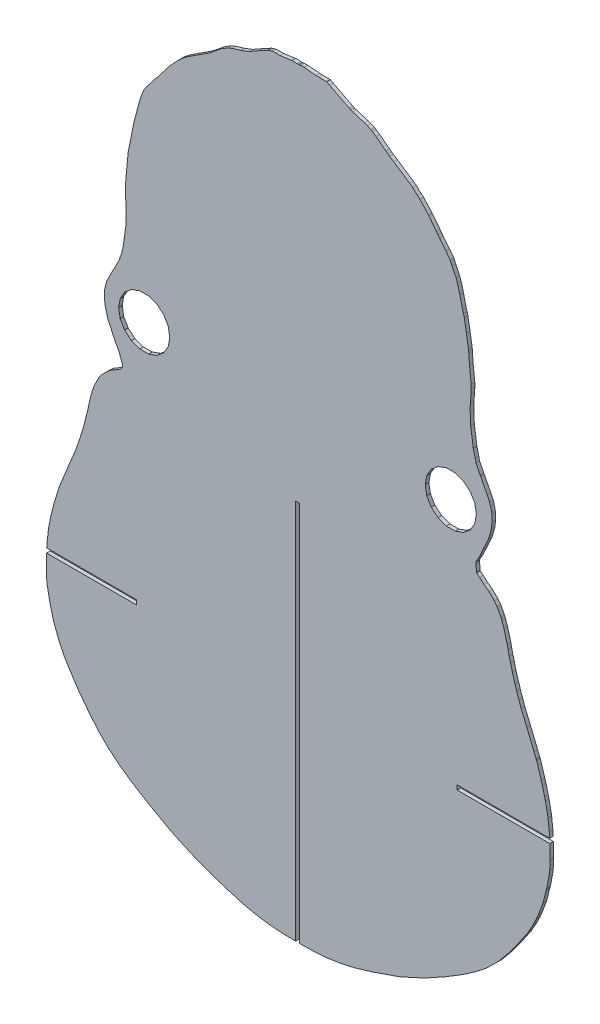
SolidWorks part; units mm, degrees
ref_plane "Спереди" through (0, 0, 0) normal (0, 0, 1) x (1, 0, 0)
ref_plane "Сверху" through (0, 0, 0) normal (0, 1, 0) x (1, 0, 0)
ref_plane "Справа" through (0, 0, 0) normal (1, 0, 0) x (0, 0, -1)
sketch "Model" plane through (0, 0, 0) normal (0, 0, 1) x (1, 0, 0)
  line L0 (-4974.158, -929.7955) -> (-4968.6351, -930.2084)
  line L1 (-4968.6351, -930.2084) -> (-4965.1293, -930.3378)
  line L2 (-4965.1293, -930.3378) -> (-4959.8611, -930.4225)
  line L3 (-4959.8611, -930.4225) -> (-4959.8611, -719.0788)
  line L4 (-4959.8611, -719.0788) -> (-4957.8611, -719.0788)
  line L5 (-4957.8611, -719.0788) -> (-4957.8611, -930.4371)
  line L6 (-4957.8611, -930.4371) -> (-4951.7398, -930.3629)
  line L7 (-4951.7398, -930.3629) -> (-4949.5986, -930.2921)
  line L8 (-4949.5986, -930.2921) -> (-4947.9002, -930.1979)
  line L9 (-4947.9002, -930.1979) -> (-4942.8325, -929.8058)
  line L10 (-4942.8325, -929.8058) -> (-4942.4503, -929.756)
  line L11 (-4942.4503, -929.756) -> (-4935.1129, -928.6329)
  line L12 (-4935.1129, -928.6329) -> (-4934.8096, -928.5712)
  line L13 (-4934.8096, -928.5712) -> (-4934.5061, -928.5092)
  line L14 (-4934.5061, -928.5092) -> (-4927.6871, -926.9908)
  line L15 (-4927.6871, -926.9908) -> (-4926.8901, -926.7667)
  line L16 (-4926.8901, -926.7667) -> (-4921.6101, -925.1852)
  line L17 (-4921.6101, -925.1852) -> (-4919.9321, -924.703)
  line L18 (-4919.9321, -924.703) -> (-4918.2541, -924.2206)
  line L19 (-4918.2541, -924.2206) -> (-4908.5771, -920.9071)
  line L20 (-4908.5771, -920.9071) -> (-4902.6554, -918.8368)
  line L21 (-4902.6554, -918.8368) -> (-4896.7513, -916.2242)
  line L22 (-4896.7513, -916.2242) -> (-4888.4404, -912.3805)
  line L23 (-4888.4404, -912.3805) -> (-4887.0179, -911.6324)
  line L24 (-4887.0179, -911.6324) -> (-4883.3795, -909.6022)
  line L25 (-4883.3795, -909.6022) -> (-4877.945, -906.5407)
  line L26 (-4877.945, -906.5407) -> (-4877.4139, -906.285)
  line L27 (-4877.4139, -906.285) -> (-4876.8827, -906.0292)
  line L28 (-4876.8827, -906.0292) -> (-4870.752, -902.2738)
  line L29 (-4870.752, -902.2738) -> (-4865.5499, -899.0272)
  line L30 (-4865.5499, -899.0272) -> (-4864.6683, -898.4178)
  line L31 (-4864.6683, -898.4178) -> (-4863.5197, -897.5741)
  line L32 (-4863.5197, -897.5741) -> (-4862.3711, -896.7306)
  line L33 (-4862.3711, -896.7306) -> (-4859.876, -895.0631)
  line L34 (-4859.876, -895.0631) -> (-4856.9983, -892.7367)
  line L35 (-4856.9983, -892.7367) -> (-4854.0229, -890.3763)
  line L36 (-4854.0229, -890.3763) -> (-4848.1192, -884.5961)
  line L37 (-4848.1192, -884.5961) -> (-4846.7538, -883.0995)
  line L38 (-4846.7538, -883.0995) -> (-4842.3308, -877.7321)
  line L39 (-4842.3308, -877.7321) -> (-4836.8335, -870.3651)
  line L40 (-4836.8335, -870.3651) -> (-4832.9334, -864.5707)
  line L41 (-4832.9334, -864.5707) -> (-4831.4924, -862.5199)
  line L42 (-4831.4924, -862.5199) -> (-4830.8341, -861.4086)
  line L43 (-4830.8341, -861.4086) -> (-4830.6526, -861.0438)
  line L44 (-4830.6526, -861.0438) -> (-4830.4712, -860.6793)
  line L45 (-4830.4712, -860.6793) -> (-4828.6733, -857.6239)
  line L46 (-4828.6733, -857.6239) -> (-4828.1669, -856.5897)
  line L47 (-4828.1669, -856.5897) -> (-4826.4759, -853.1464)
  line L48 (-4826.4759, -853.1464) -> (-4825.3825, -850.5316)
  line L49 (-4825.3825, -850.5316) -> (-4822.6957, -843.3907)
  line L50 (-4822.6957, -843.3907) -> (-4822.6899, -843.3458)
  line L51 (-4822.6899, -843.3458) -> (-4822.6841, -843.3009)
  line L52 (-4822.6841, -843.3009) -> (-4821.1044, -836.9054)
  line L53 (-4821.1044, -836.9054) -> (-4820.9418, -836.3578)
  line L54 (-4820.9418, -836.3578) -> (-4820.7793, -835.8099)
  line L55 (-4820.7793, -835.8099) -> (-4820.6542, -835.2631)
  line L56 (-4820.6542, -835.2631) -> (-4819.4245, -829.0065)
  line L57 (-4819.4245, -829.0065) -> (-4819.0711, -826.1041)
  line L58 (-4819.0711, -826.1041) -> (-4818.8331, -823.6173)
  line L59 (-4818.8331, -823.6173) -> (-4818.8422, -821.382)
  line L60 (-4818.8422, -821.382) -> (-4818.8378, -821.0985)
  line L61 (-4818.8378, -821.0985) -> (-4818.8757, -820.3788)
  line L62 (-4818.8757, -820.3788) -> (-4818.9844, -813.0892)
  line L63 (-4818.9844, -813.0892) -> (-4870.3844, -813.0892)
  line L64 (-4870.3844, -813.0892) -> (-4870.3844, -812.8392)
  line L65 (-4870.3844, -812.8392) -> (-4870.3844, -810.8392)
  line L66 (-4870.3844, -810.8392) -> (-4870.3844, -810.5892)
  line L67 (-4870.3844, -810.5892) -> (-4819.0458, -810.5892)
  line L68 (-4819.0458, -810.5892) -> (-4819.2605, -807.7255)
  line L69 (-4819.2605, -807.7255) -> (-4819.9747, -801.4142)
  line L70 (-4819.9747, -801.4142) -> (-4820.2251, -799.7928)
  line L71 (-4820.2251, -799.7928) -> (-4821.3856, -793.9696)
  line L72 (-4821.3856, -793.9696) -> (-4821.8597, -792.1036)
  line L73 (-4821.8597, -792.1036) -> (-4823.0798, -787.2887)
  line L74 (-4823.0798, -787.2887) -> (-4823.752, -784.9999)
  line L75 (-4823.752, -784.9999) -> (-4825.7052, -778.6901)
  line L76 (-4825.7052, -778.6901) -> (-4826.2635, -777.0309)
  line L77 (-4826.2635, -777.0309) -> (-4826.3465, -776.7943)
  line L78 (-4826.3465, -776.7943) -> (-4826.4295, -776.558)
  line L79 (-4826.4295, -776.558) -> (-4826.5423, -776.2694)
  line L80 (-4826.5423, -776.2694) -> (-4826.6551, -775.9811)
  line L81 (-4826.6551, -775.9811) -> (-4827.7262, -773.4261)
  line L82 (-4827.7262, -773.4261) -> (-4831.693, -763.6888)
  line L83 (-4831.693, -763.6888) -> (-4834.8637, -756.1723)
  line L84 (-4834.8637, -756.1723) -> (-4836.147, -752.5556)
  line L85 (-4836.147, -752.5556) -> (-4837.3583, -749.0107)
  line L86 (-4837.3583, -749.0107) -> (-4838.2948, -746.0696)
  line L87 (-4838.2948, -746.0696) -> (-4839.7543, -741.1841)
  line L88 (-4839.7543, -741.1841) -> (-4840.73, -737.2285)
  line L89 (-4840.73, -737.2285) -> (-4841.5153, -734.2759)
  line L90 (-4841.5153, -734.2759) -> (-4842.1721, -731.301)
  line L91 (-4842.1721, -731.301) -> (-4842.5612, -729.4475)
  line L92 (-4842.5612, -729.4475) -> (-4844.4167, -722.4553)
  line L93 (-4844.4167, -722.4553) -> (-4845.615, -719.1135)
  line L94 (-4845.615, -719.1135) -> (-4846.1162, -717.8667)
  line L95 (-4846.1162, -717.8667) -> (-4848.1593, -714.0344)
  line L96 (-4848.1593, -714.0344) -> (-4849.7675, -711.9243)
  line L97 (-4849.7675, -711.9243) -> (-4852.7505, -708.843)
  line L98 (-4852.7505, -708.843) -> (-4855.4501, -706.9629)
  line L99 (-4855.4501, -706.9629) -> (-4857.8761, -704.7331)
  line L100 (-4857.8761, -704.7331) -> (-4859.5853, -703.469)
  line L101 (-4859.5853, -703.469) -> (-4859.6002, -703.4375)
  line L102 (-4859.6002, -703.4375) -> (-4859.6152, -703.406)
  line L103 (-4859.6152, -703.406) -> (-4859.6202, -703.1538)
  line L104 (-4859.6202, -703.1538) -> (-4859.9137, -699.2248)
  line L105 (-4859.9137, -699.2248) -> (-4859.8963, -698.3071)
  line L106 (-4859.8963, -698.3071) -> (-4859.1325, -696.74)
  line L107 (-4859.1325, -696.74) -> (-4857.966, -694.8115)
  line L108 (-4857.966, -694.8115) -> (-4856.0334, -690.5195)
  line L109 (-4856.0334, -690.5195) -> (-4856.0332, -690.5188)
  line L110 (-4856.0332, -690.5188) -> (-4856.0329, -690.5183)
  line L111 (-4856.0329, -690.5183) -> (-4856.0325, -690.5173)
  line L112 (-4856.0325, -690.5173) -> (-4856.0322, -690.5163)
  line L113 (-4856.0322, -690.5163) -> (-4852.987, -683.9487)
  line L114 (-4852.987, -683.9487) -> (-4852.4202, -682.0217)
  line L115 (-4852.4202, -682.0217) -> (-4851.3934, -678.1655)
  line L116 (-4851.3934, -678.1655) -> (-4851.0131, -674.6946)
  line L117 (-4851.0131, -674.6946) -> (-4851.1242, -670.8762)
  line L118 (-4851.1242, -670.8762) -> (-4851.28, -669.9158)
  line L119 (-4851.28, -669.9158) -> (-4851.8411, -667.6953)
  line L120 (-4851.8411, -667.6953) -> (-4852.3329, -665.9238)
  line L121 (-4852.3329, -665.9238) -> (-4853.6626, -662.9949)
  line L122 (-4853.6626, -662.9949) -> (-4857.2618, -656.0876)
  line L123 (-4857.2618, -656.0876) -> (-4857.4419, -655.7597)
  line L124 (-4857.4419, -655.7597) -> (-4857.6221, -655.4321)
  line L125 (-4857.6221, -655.4321) -> (-4857.6708, -655.3193)
  line L126 (-4857.6708, -655.3193) -> (-4859.894, -650.8657)
  line L127 (-4859.894, -650.8657) -> (-4860.3363, -648.8789)
  line L128 (-4860.3363, -648.8789) -> (-4861.37, -644.7202)
  line L129 (-4861.37, -644.7202) -> (-4861.4316, -644.3179)
  line L130 (-4861.4316, -644.3179) -> (-4862.8359, -634.3913)
  line L131 (-4862.8359, -634.3913) -> (-4862.841, -634.3581)
  line L132 (-4862.841, -634.3581) -> (-4862.8462, -634.3249)
  line L133 (-4862.8462, -634.3249) -> (-4862.8466, -634.3218)
  line L134 (-4862.8466, -634.3218) -> (-4862.847, -634.3186)
  line L135 (-4862.847, -634.3186) -> (-4863.1181, -627.4463)
  line L136 (-4863.1181, -627.4463) -> (-4863.0723, -623.7153)
  line L137 (-4863.0723, -623.7153) -> (-4862.6688, -619.4426)
  line L138 (-4862.6688, -619.4426) -> (-4862.5345, -616.4482)
  line L139 (-4862.5345, -616.4482) -> (-4862.5747, -614.5293)
  line L140 (-4862.5747, -614.5293) -> (-4863.5302, -605.414)
  line L141 (-4863.5302, -605.414) -> (-4863.9102, -600.1826)
  line L142 (-4863.9102, -600.1826) -> (-4863.9584, -598.9465)
  line L143 (-4863.9584, -598.9465) -> (-4864.0995, -597.9158)
  line L144 (-4864.0995, -597.9158) -> (-4865.1712, -591.3637)
  line L145 (-4865.1712, -591.3637) -> (-4866.3972, -584.3789)
  line L146 (-4866.3972, -584.3789) -> (-4866.7994, -582.813)
  line L147 (-4866.7994, -582.813) -> (-4867.3376, -580.9602)
  line L148 (-4867.3376, -580.9602) -> (-4868.8091, -574.6103)
  line L149 (-4868.8091, -574.6103) -> (-4870.1731, -569.5923)
  line L150 (-4870.1731, -569.5923) -> (-4871.0017, -567.237)
  line L151 (-4871.0017, -567.237) -> (-4873.1798, -562.8191)
  line L152 (-4873.1798, -562.8191) -> (-4874.2875, -560.3891)
  line L153 (-4874.2875, -560.3891) -> (-4876.5796, -557.3596)
  line L154 (-4876.5796, -557.3596) -> (-4880.1191, -553.0461)
  line L155 (-4880.1191, -553.0461) -> (-4881.0413, -551.7251)
  line L156 (-4881.0413, -551.7251) -> (-4881.8473, -550.5952)
  line L157 (-4881.8473, -550.5952) -> (-4886.07, -545.1618)
  line L158 (-4886.07, -545.1618) -> (-4886.1833, -545.021)
  line L159 (-4886.1833, -545.021) -> (-4886.2966, -544.8804)
  line L160 (-4886.2966, -544.8804) -> (-4891.0608, -539.6433)
  line L161 (-4891.0608, -539.6433) -> (-4892.4383, -538.5622)
  line L162 (-4892.4383, -538.5622) -> (-4895.2125, -535.8989)
  line L163 (-4895.2125, -535.8989) -> (-4896.6491, -534.8926)
  line L164 (-4896.6491, -534.8926) -> (-4905.5206, -528.9497)
  line L165 (-4905.5206, -528.9497) -> (-4907.8607, -527.4783)
  line L166 (-4907.8607, -527.4783) -> (-4908.7246, -526.8691)
  line L167 (-4908.7246, -526.8691) -> (-4909.7869, -526.008)
  line L168 (-4909.7869, -526.008) -> (-4915.2931, -521.7969)
  line L169 (-4915.2931, -521.7969) -> (-4917.3051, -520.4197)
  line L170 (-4917.3051, -520.4197) -> (-4917.7934, -520.1213)
  line L171 (-4917.7934, -520.1213) -> (-4918.2818, -519.823)
  line L172 (-4918.2818, -519.823) -> (-4920.2479, -518.9287)
  line L173 (-4920.2479, -518.9287) -> (-4921.712, -518.3862)
  line L174 (-4921.712, -518.3862) -> (-4928.1213, -516.4355)
  line L175 (-4928.1213, -516.4355) -> (-4928.5135, -516.3276)
  line L176 (-4928.5135, -516.3276) -> (-4928.9057, -516.2197)
  line L177 (-4928.9057, -516.2197) -> (-4929.3313, -516.0168)
  line L178 (-4929.3313, -516.0168) -> (-4929.8046, -515.7688)
  line L179 (-4929.8046, -515.7688) -> (-4930.2778, -515.5207)
  line L180 (-4930.2778, -515.5207) -> (-4941.071, -510.0259)
  line L181 (-4941.071, -510.0259) -> (-4942.542, -509.2473)
  line L182 (-4942.542, -509.2473) -> (-4942.7693, -509.1418)
  line L183 (-4942.7693, -509.1418) -> (-4947.0627, -509.094)
  line L184 (-4947.0627, -509.094) -> (-4948.4269, -509.0908)
  line L185 (-4948.4269, -509.0908) -> (-4948.4885, -509.094)
  line L186 (-4948.4885, -509.094) -> (-4948.55, -509.0974)
  line L187 (-4948.55, -509.0974) -> (-4954.9997, -508.4509)
  line L188 (-4954.9997, -508.4509) -> (-4955.3121, -508.4067)
  line L189 (-4955.3121, -508.4067) -> (-4956.9597, -508.5312)
  line L190 (-4956.9597, -508.5312) -> (-4957.3478, -508.5642)
  line L191 (-4957.3478, -508.5642) -> (-4957.7359, -508.5971)
  line L192 (-4957.7359, -508.5971) -> (-4957.8421, -508.6238)
  line L193 (-4957.8421, -508.6238) -> (-4957.9483, -508.6504)
  line L194 (-4957.9483, -508.6504) -> (-4958.0066, -508.6513)
  line L195 (-4958.0066, -508.6513) -> (-4958.4723, -508.6294)
  line L196 (-4958.4723, -508.6294) -> (-4958.9379, -508.6076)
  line L197 (-4958.9379, -508.6076) -> (-4961.6012, -508.5432)
  line L198 (-4961.6012, -508.5432) -> (-4962.0373, -508.5957)
  line L199 (-4962.0373, -508.5957) -> (-4962.2339, -508.6333)
  line L200 (-4962.2339, -508.6333) -> (-4962.4303, -508.6709)
  line L201 (-4962.4303, -508.6709) -> (-4968.7091, -509.5178)
  line L202 (-4968.7091, -509.5178) -> (-4969.7684, -509.4753)
  line L203 (-4969.7684, -509.4753) -> (-4970.8276, -509.4328)
  line L204 (-4970.8276, -509.4328) -> (-4972.7218, -509.5388)
  line L205 (-4972.7218, -509.5388) -> (-4973.7364, -509.8718)
  line L206 (-4973.7364, -509.8718) -> (-4974.7509, -510.2051)
  line L207 (-4974.7509, -510.2051) -> (-4975.3609, -510.344)
  line L208 (-4975.3609, -510.344) -> (-4977.9656, -511.8984)
  line L209 (-4977.9656, -511.8984) -> (-4979.7461, -512.7612)
  line L210 (-4979.7461, -512.7612) -> (-4985.8459, -516.2109)
  line L211 (-4985.8459, -516.2109) -> (-4990.3016, -517.8916)
  line L212 (-4990.3016, -517.8916) -> (-4990.573, -517.968)
  line L213 (-4990.573, -517.968) -> (-4994.9819, -519.2717)
  line L214 (-4994.9819, -519.2717) -> (-4997.1963, -520.2471)
  line L215 (-4997.1963, -520.2471) -> (-5000.6361, -522.1443)
  line L216 (-5000.6361, -522.1443) -> (-5000.9295, -522.3701)
  line L217 (-5000.9295, -522.3701) -> (-5001.2229, -522.5959)
  line L218 (-5001.2229, -522.5959) -> (-5007.8338, -527.9165)
  line L219 (-5007.8338, -527.9165) -> (-5013.9421, -531.8899)
  line L220 (-5013.9421, -531.8899) -> (-5019.9042, -535.7637)
  line L221 (-5019.9042, -535.7637) -> (-5023.0545, -538.1955)
  line L222 (-5023.0545, -538.1955) -> (-5025.4924, -540.4707)
  line L223 (-5025.4924, -540.4707) -> (-5029.9923, -545.3574)
  line L224 (-5029.9923, -545.3574) -> (-5030.0162, -545.3869)
  line L225 (-5030.0162, -545.3869) -> (-5030.04, -545.4165)
  line L226 (-5030.04, -545.4165) -> (-5030.2854, -545.7341)
  line L227 (-5030.2854, -545.7341) -> (-5036.7858, -554.2068)
  line L228 (-5036.7858, -554.2068) -> (-5037.5456, -555.0381)
  line L229 (-5037.5456, -555.0381) -> (-5038.4139, -556.0493)
  line L230 (-5038.4139, -556.0493) -> (-5040.6311, -559.0368)
  line L231 (-5040.6311, -559.0368) -> (-5042.7709, -561.7732)
  line L232 (-5042.7709, -561.7732) -> (-5044.0081, -563.6841)
  line L233 (-5044.0081, -563.6841) -> (-5045.2438, -566.5271)
  line L234 (-5045.2438, -566.5271) -> (-5046.164, -569.4292)
  line L235 (-5046.164, -569.4292) -> (-5046.6401, -570.9145)
  line L236 (-5046.6401, -570.9145) -> (-5049.4321, -581.6291)
  line L237 (-5049.4321, -581.6291) -> (-5049.4399, -581.6565)
  line L238 (-5049.4399, -581.6565) -> (-5049.4477, -581.6838)
  line L239 (-5049.4477, -581.6838) -> (-5049.4604, -581.7261)
  line L240 (-5049.4604, -581.7261) -> (-5049.4732, -581.7683)
  line L241 (-5049.4732, -581.7683) -> (-5050.3082, -585.8926)
  line L242 (-5050.3082, -585.8926) -> (-5052.7453, -597.9602)
  line L243 (-5052.7453, -597.9602) -> (-5053.0653, -601.185)
  line L244 (-5053.0653, -601.185) -> (-5054.2401, -614.0129)
  line L245 (-5054.2401, -614.0129) -> (-5054.3111, -616.4817)
  line L246 (-5054.3111, -616.4817) -> (-5054.1294, -620.865)
  line L247 (-5054.1294, -620.865) -> (-5053.8653, -624.2263)
  line L248 (-5053.8653, -624.2263) -> (-5053.8126, -627.0261)
  line L249 (-5053.8126, -627.0261) -> (-5054.0817, -634.468)
  line L250 (-5054.0817, -634.468) -> (-5054.0818, -634.4709)
  line L251 (-5054.0818, -634.4709) -> (-5054.0818, -634.4741)
  line L252 (-5054.0818, -634.4741) -> (-5054.0818, -634.4753)
  line L253 (-5054.0818, -634.4753) -> (-5054.082, -634.478)
  line L254 (-5054.082, -634.478) -> (-5055.513, -644.4607)
  line L255 (-5055.513, -644.4607) -> (-5055.6158, -645.0737)
  line L256 (-5055.6158, -645.0737) -> (-5056.5313, -649.0344)
  line L257 (-5056.5313, -649.0344) -> (-5057.1505, -650.3149)
  line L258 (-5057.1505, -650.3149) -> (-5057.5707, -652.0019)
  line L259 (-5057.5707, -652.0019) -> (-5059.2935, -655.3701)
  line L260 (-5059.2935, -655.3701) -> (-5059.3111, -655.4184)
  line L261 (-5059.3111, -655.4184) -> (-5059.3287, -655.467)
  line L262 (-5059.3287, -655.467) -> (-5059.3846, -655.5666)
  line L263 (-5059.3846, -655.5666) -> (-5059.4406, -655.6665)
  line L264 (-5059.4406, -655.6665) -> (-5063.3718, -663.1562)
  line L265 (-5063.3718, -663.1562) -> (-5064.6885, -666.0378)
  line L266 (-5064.6885, -666.0378) -> (-5065.1107, -667.7178)
  line L267 (-5065.1107, -667.7178) -> (-5065.6793, -669.821)
  line L268 (-5065.6793, -669.821) -> (-5065.8625, -670.8962)
  line L269 (-5065.8625, -670.8962) -> (-5065.9435, -674.4319)
  line L270 (-5065.9435, -674.4319) -> (-5065.525, -677.9663)
  line L271 (-5065.525, -677.9663) -> (-5064.442, -682.1885)
  line L272 (-5064.442, -682.1885) -> (-5063.8631, -684.1135)
  line L273 (-5063.8631, -684.1135) -> (-5062.1041, -687.7156)
  line L274 (-5062.1041, -687.7156) -> (-5061.7643, -688.6572)
  line L275 (-5061.7643, -688.6572) -> (-5061.323, -689.675)
  line L276 (-5061.323, -689.675) -> (-5058.7935, -694.5998)
  line L277 (-5058.7935, -694.5998) -> (-5057.3415, -697.331)
  line L278 (-5057.3415, -697.331) -> (-5057.1786, -698.1245)
  line L279 (-5057.1786, -698.1245) -> (-5055.9685, -701.3669)
  line L280 (-5055.9685, -701.3669) -> (-5055.9156, -702.7766)
  line L281 (-5055.9156, -702.7766) -> (-5057.136, -704.5237)
  line L282 (-5057.136, -704.5237) -> (-5061.8888, -707.1865)
  line L283 (-5061.8888, -707.1865) -> (-5063.264, -708.1726)
  line L284 (-5063.264, -708.1726) -> (-5063.5638, -708.4267)
  line L285 (-5063.5638, -708.4267) -> (-5063.8636, -708.6809)
  line L286 (-5063.8636, -708.6809) -> (-5067.2123, -711.9514)
  line L287 (-5067.2123, -711.9514) -> (-5067.8894, -712.8371)
  line L288 (-5067.8894, -712.8371) -> (-5068.7171, -713.8647)
  line L289 (-5068.7171, -713.8647) -> (-5069.3651, -715.1662)
  line L290 (-5069.3651, -715.1662) -> (-5071.3375, -718.8957)
  line L291 (-5071.3375, -718.8957) -> (-5072.6297, -722.4228)
  line L292 (-5072.6297, -722.4228) -> (-5074.1659, -728.3747)
  line L293 (-5074.1659, -728.3747) -> (-5074.7159, -730.8867)
  line L294 (-5074.7159, -730.8867) -> (-5075.4173, -734.1169)
  line L295 (-5075.4173, -734.1169) -> (-5076.2616, -737.3086)
  line L296 (-5076.2616, -737.3086) -> (-5077.2062, -741.1899)
  line L297 (-5077.2062, -741.1899) -> (-5078.5041, -745.5989)
  line L298 (-5078.5041, -745.5989) -> (-5079.3273, -748.2143)
  line L299 (-5079.3273, -748.2143) -> (-5080.6569, -752.125)
  line L300 (-5080.6569, -752.125) -> (-5082.0079, -755.9734)
  line L301 (-5082.0079, -755.9734) -> (-5085.2583, -763.7289)
  line L302 (-5085.2583, -763.7289) -> (-5089.6342, -774.4716)
  line L303 (-5089.6342, -774.4716) -> (-5090.5229, -776.5992)
  line L304 (-5090.5229, -776.5992) -> (-5090.6801, -777.0006)
  line L305 (-5090.6801, -777.0006) -> (-5090.7388, -777.1683)
  line L306 (-5090.7388, -777.1683) -> (-5090.7975, -777.3361)
  line L307 (-5090.7975, -777.3361) -> (-5091.1838, -778.4845)
  line L308 (-5091.1838, -778.4845) -> (-5093.0766, -784.6451)
  line L309 (-5093.0766, -784.6451) -> (-5093.8112, -787.0807)
  line L310 (-5093.8112, -787.0807) -> (-5095.1102, -792.184)
  line L311 (-5095.1102, -792.184) -> (-5095.5961, -794.0072)
  line L312 (-5095.5961, -794.0072) -> (-5096.8094, -800.1559)
  line L313 (-5096.8094, -800.1559) -> (-5097.0365, -801.7372)
  line L314 (-5097.0365, -801.7372) -> (-5097.7363, -808.0878)
  line L315 (-5097.7363, -808.0878) -> (-5097.9212, -810.5892)
  line L316 (-5097.9212, -810.5892) -> (-5048.1548, -810.5892)
  line L317 (-5048.1548, -810.5892) -> (-5048.1548, -810.8392)
  line L318 (-5048.1548, -810.8392) -> (-5048.1548, -812.8392)
  line L319 (-5048.1548, -812.8392) -> (-5048.1548, -813.0892)
  line L320 (-5048.1548, -813.0892) -> (-5097.9894, -813.0892)
  line L321 (-5097.9894, -813.0892) -> (-5098.0832, -819.8751)
  line L322 (-5098.0832, -819.8751) -> (-5098.128, -820.705)
  line L323 (-5098.128, -820.705) -> (-5098.1254, -820.8866)
  line L324 (-5098.1254, -820.8866) -> (-5098.1227, -821.0685)
  line L325 (-5098.1227, -821.0685) -> (-5098.1179, -823.777)
  line L326 (-5098.1179, -823.777) -> (-5097.9231, -825.785)
  line L327 (-5097.9231, -825.785) -> (-5097.6063, -828.5472)
  line L328 (-5097.6063, -828.5472) -> (-5096.0934, -836.2472)
  line L329 (-5096.0934, -836.2472) -> (-5096.0822, -836.3363)
  line L330 (-5096.0822, -836.3363) -> (-5096.071, -836.4257)
  line L331 (-5096.071, -836.4257) -> (-5096.0315, -836.5878)
  line L332 (-5096.0315, -836.5878) -> (-5095.9921, -836.7496)
  line L333 (-5095.9921, -836.7496) -> (-5094.0677, -844.0004)
  line L334 (-5094.0677, -844.0004) -> (-5091.8276, -849.8749)
  line L335 (-5091.8276, -849.8749) -> (-5090.4521, -853.1967)
  line L336 (-5090.4521, -853.1967) -> (-5088.7991, -856.5538)
  line L337 (-5088.7991, -856.5538) -> (-5088.5088, -857.14)
  line L338 (-5088.5088, -857.14) -> (-5088.2186, -857.7264)
  line L339 (-5088.2186, -857.7264) -> (-5086.3559, -860.848)
  line L340 (-5086.3559, -860.848) -> (-5086.1883, -861.1923)
  line L341 (-5086.1883, -861.1923) -> (-5086.0206, -861.5363)
  line L342 (-5086.0206, -861.5363) -> (-5084.2698, -863.9178)
  line L343 (-5084.2698, -863.9178) -> (-5083.826, -864.7177)
  line L344 (-5083.826, -864.7177) -> (-5083.3823, -865.5172)
  line L345 (-5083.3823, -865.5172) -> (-5080.1811, -870.297)
  line L346 (-5080.1811, -870.297) -> (-5078.3669, -872.6993)
  line L347 (-5078.3669, -872.6993) -> (-5074.7412, -877.5411)
  line L348 (-5074.7412, -877.5411) -> (-5069.9459, -883.2941)
  line L349 (-5069.9459, -883.2941) -> (-5069.3696, -883.9428)
  line L350 (-5069.3696, -883.9428) -> (-5068.7933, -884.5917)
  line L351 (-5068.7933, -884.5917) -> (-5068.5794, -884.8143)
  line L352 (-5068.5794, -884.8143) -> (-5068.3655, -885.0372)
  line L353 (-5068.3655, -885.0372) -> (-5063.2694, -890.1049)
  line L354 (-5063.2694, -890.1049) -> (-5062.4997, -890.6273)
  line L355 (-5062.4997, -890.6273) -> (-5059.2945, -893.3265)
  line L356 (-5059.2945, -893.3265) -> (-5058.1641, -894.2294)
  line L357 (-5058.1641, -894.2294) -> (-5057.0337, -895.1324)
  line L358 (-5057.0337, -895.1324) -> (-5053.5307, -897.5194)
  line L359 (-5053.5307, -897.5194) -> (-5052.0913, -898.5736)
  line L360 (-5052.0913, -898.5736) -> (-5051.706, -898.8422)
  line L361 (-5051.706, -898.8422) -> (-5048.4551, -900.9313)
  line L362 (-5048.4551, -900.9313) -> (-5041.6824, -905.0778)
  line L363 (-5041.6824, -905.0778) -> (-5039.4375, -906.3204)
  line L364 (-5039.4375, -906.3204) -> (-5033.5016, -909.6642)
  line L365 (-5033.5016, -909.6642) -> (-5029.9157, -911.6671)
  line L366 (-5029.9157, -911.6671) -> (-5028.5139, -912.4069)
  line L367 (-5028.5139, -912.4069) -> (-5019.8243, -916.4142)
  line L368 (-5019.8243, -916.4142) -> (-5014.6201, -918.7194)
  line L369 (-5014.6201, -918.7194) -> (-5007.1617, -921.3346)
  line L370 (-5007.1617, -921.3346) -> (-4999.8722, -923.9178)
  line L371 (-4999.8722, -923.9178) -> (-4993.986, -925.5853)
  line L372 (-4993.986, -925.5853) -> (-4990.1852, -926.744)
  line L373 (-4990.1852, -926.744) -> (-4989.4092, -926.9618)
  line L374 (-4989.4092, -926.9618) -> (-4982.4026, -928.5233)
  line L375 (-4982.4026, -928.5233) -> (-4982.0816, -928.5887)
  line L376 (-4982.0816, -928.5887) -> (-4981.7606, -928.6539)
  line L377 (-4981.7606, -928.6539) -> (-4974.4564, -929.7584)
  line L378 (-4974.4564, -929.7584) -> (-4974.158, -929.7955)
  line L379 (-4866.7734, -663.0473) -> (-4863.0021, -666.2119)
  line L380 (-4863.0021, -666.2119) -> (-4860.5406, -670.4753)
  line L381 (-4860.5406, -670.4753) -> (-4859.6857, -675.3235)
  line L382 (-4859.6857, -675.3235) -> (-4860.5406, -680.1719)
  line L383 (-4860.5406, -680.1719) -> (-4863.0021, -684.4353)
  line L384 (-4863.0021, -684.4353) -> (-4866.7734, -687.5998)
  line L385 (-4866.7734, -687.5998) -> (-4871.3996, -689.2837)
  line L386 (-4871.3996, -689.2837) -> (-4876.3227, -689.2837)
  line L387 (-4876.3227, -689.2837) -> (-4880.9488, -687.5998)
  line L388 (-4880.9488, -687.5998) -> (-4884.7201, -684.4353)
  line L389 (-4884.7201, -684.4353) -> (-4887.1817, -680.1719)
  line L390 (-4887.1817, -680.1719) -> (-4888.0366, -675.3237)
  line L391 (-4888.0366, -675.3237) -> (-4887.1817, -670.4753)
  line L392 (-4887.1817, -670.4753) -> (-4884.7201, -666.2119)
  line L393 (-4884.7201, -666.2119) -> (-4880.9488, -663.0473)
  line L394 (-4880.9488, -663.0473) -> (-4876.3227, -661.3635)
  line L395 (-4876.3227, -661.3635) -> (-4871.3996, -661.3635)
  line L396 (-4871.3996, -661.3635) -> (-4866.7734, -663.0473)
  line L397 (-5057.1817, -680.1719) -> (-5054.7201, -684.4353)
  line L398 (-5054.7201, -684.4353) -> (-5050.9488, -687.5998)
  line L399 (-5050.9488, -687.5998) -> (-5046.3227, -689.2837)
  line L400 (-5046.3227, -689.2837) -> (-5041.3996, -689.2837)
  line L401 (-5041.3996, -689.2837) -> (-5036.7734, -687.5998)
  line L402 (-5036.7734, -687.5998) -> (-5033.0021, -684.4353)
  line L403 (-5033.0021, -684.4353) -> (-5030.5406, -680.1719)
  line L404 (-5030.5406, -680.1719) -> (-5029.6857, -675.3235)
  line L405 (-5029.6857, -675.3235) -> (-5030.5406, -670.4753)
  line L406 (-5030.5406, -670.4753) -> (-5033.0021, -666.2119)
  line L407 (-5033.0021, -666.2119) -> (-5036.7734, -663.0473)
  line L408 (-5036.7734, -663.0473) -> (-5041.3996, -661.3635)
  line L409 (-5041.3996, -661.3635) -> (-5046.3227, -661.3635)
  line L410 (-5046.3227, -661.3635) -> (-5050.9488, -663.0473)
  line L411 (-5050.9488, -663.0473) -> (-5054.7201, -666.2119)
  line L412 (-5054.7201, -666.2119) -> (-5057.1817, -670.4753)
  line L413 (-5057.1817, -670.4753) -> (-5058.0366, -675.3237)
  line L414 (-5058.0366, -675.3237) -> (-5057.1817, -680.1719)
extrude "Бобышка-Вытянуть1" add sketch "Model" along normal blind 2
